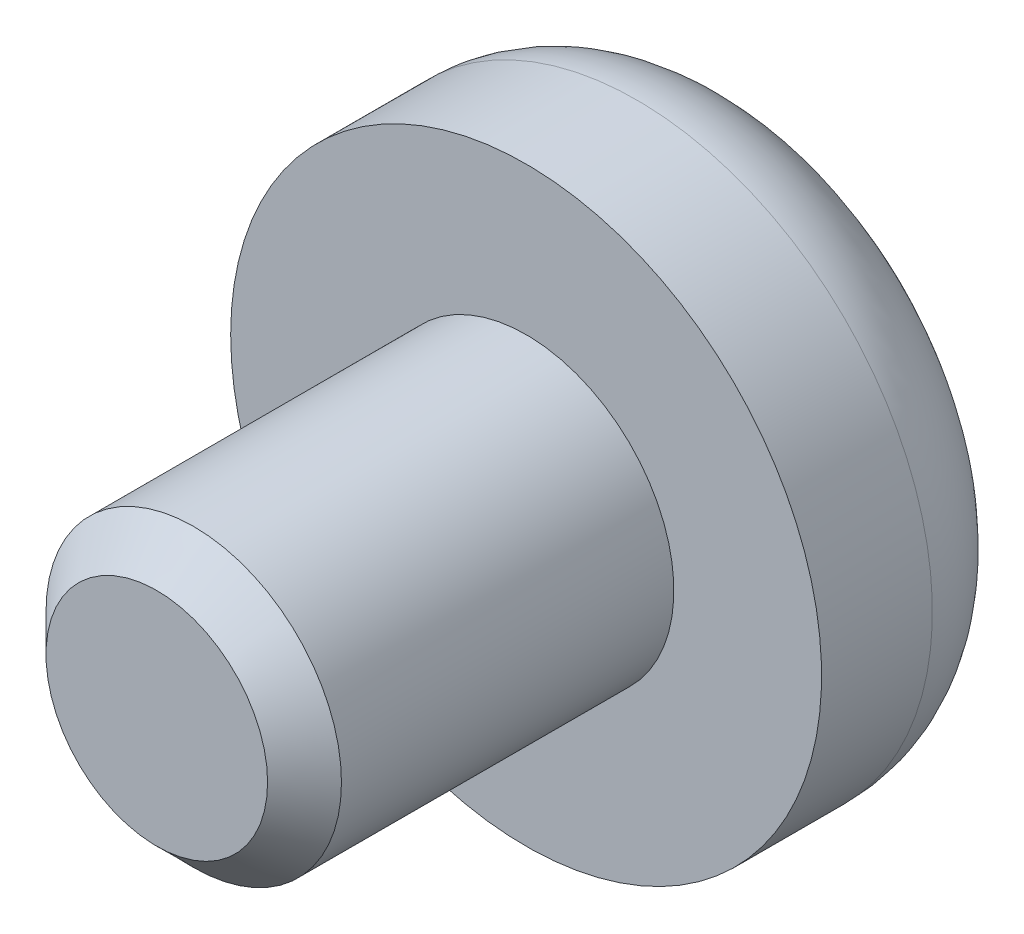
SolidWorks part; units mm, degrees
ref_plane "Plan de face" through (0, 0, 0) normal (0, 0, 1) x (1, 0, 0)
ref_plane "Plan de dessus" through (0, 0, 0) normal (0, 1, 0) x (1, 0, 0)
ref_plane "Plan de droite" through (0, 0, 0) normal (1, 0, 0) x (0, 0, -1)
sketch "Esquisse1" plane through (0, 0, 0) normal (0, 0, 1) x (1, 0, 0)
  circle A0 centre (0, 0) radius 2
extrude "Boss.-Extru.1" add sketch "Esquisse1" along normal blind 5
sketch "Esquisse2" plane through (0, 0, 0) normal (0, 0, -1) x (-1, 0, 0)
  circle A0 centre (0, 0) radius 4
extrude "Boss.-Extru.2" add sketch "Esquisse2" along normal blind 3
fillet "Congé1" radius 1.5 1 edges at (-4, 0, -3)
chamfer "Chanfrein1" distance 0.5 angle 45 1 edges at (2, 0, 5)
